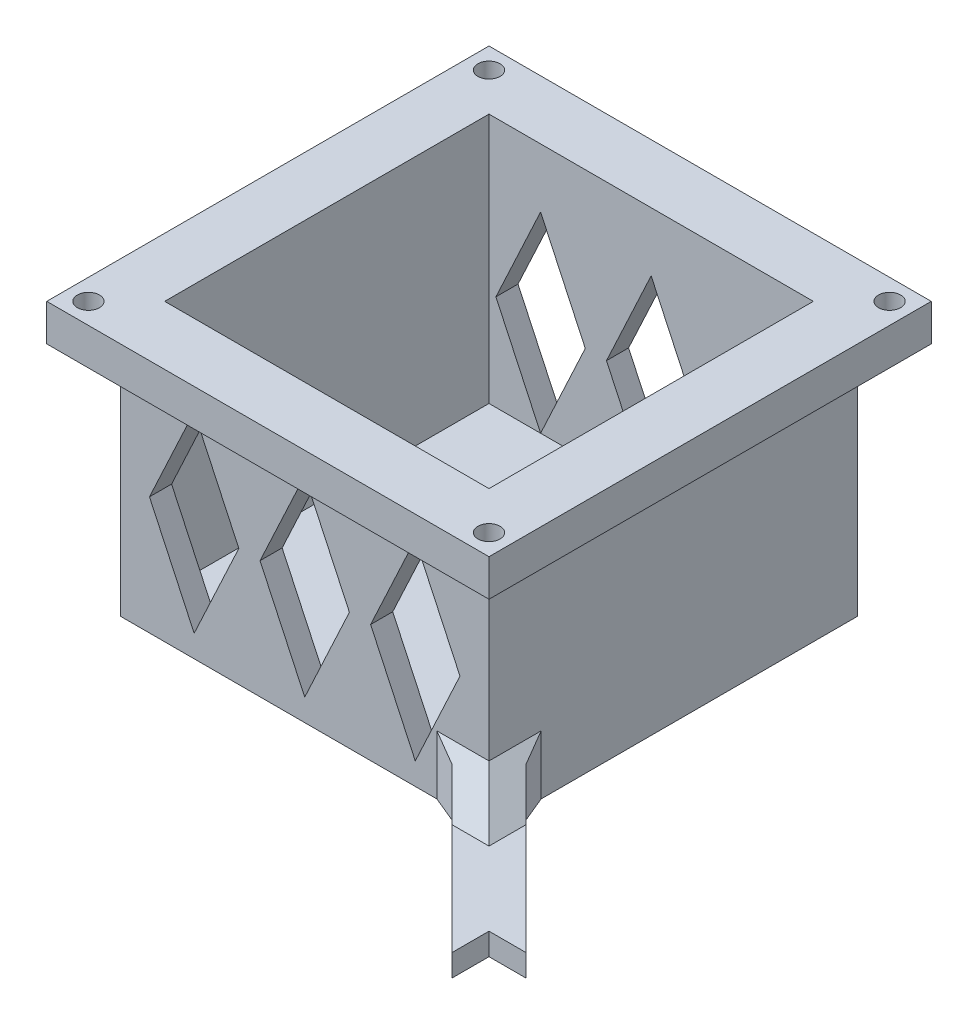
SolidWorks part; units mm, degrees
ref_plane "Front Plane" through (0, 0, 0) normal (0, 0, 1) x (1, 0, 0)
ref_plane "Top Plane" through (0, 0, 0) normal (0, 1, 0) x (1, 0, 0)
ref_plane "Right Plane" through (0, 0, 0) normal (1, 0, 0) x (0, 0, -1)
sketch "Sketch2" plane through (0, 0, 0) normal (0, 1, 0) x (1, 0, 0)
  line L1 (0, 0) -> (50, 0)
  line L2 (0, 0) -> (0, 50)
  line L3 (0, 50) -> (50, 50)
  line L4 (50, 0) -> (50, 50)
  dimension "D1" = 50
  dimension "D2" = 50
extrude "Boss-Extrude1" add sketch "Sketch2" along normal blind 37
sketch "Sketch3" plane through (0, 37, 0) normal (0, 1, 0) x (1, 0, 0)
  line L8 (3, 47) -> (3, 3)
  line L9 (3, 3) -> (47, 3)
  line L10 (47, 3) -> (47, 47)
  line L11 (47, 47) -> (3, 47)
  line L12 (3, 47) -> (3, 3)
  line L13 (3, 3) -> (47, 3)
  line L14 (47, 3) -> (47, 47)
  line L15 (47, 47) -> (3, 47)
  dimension "D1" = 3
extrude "Cut-Extrude1" cut sketch "Sketch3" against normal offset from surface (34 mm away) 3
sketch "Sketch4" plane through (0, 0, 0) normal (0, -1, 0) x (1, 0, 0)
  line L0 (50, 0) -> (50, 15) construction
  line L1 (50, 15) -> (65, 15) construction
  line L2 (50, 0) -> (45, 0)
  line L3 (0, 0) -> (50, 0) construction
  line L4 (45, 0) -> (45, 20)
  line L5 (45, 20) -> (65, 20)
  line L6 (65, 20) -> (65, 15)
  line L7 (65, 15) -> (70, 15)
  line L8 (70, 15) -> (70, -5)
  line L9 (70, -5) -> (50, -5)
  line L10 (50, 0) -> (50, -50) construction
  line L11 (50, -5) -> (50, 0)
  dimension "D1" = 15
  dimension "D2" = 15
  dimension "D3" = 5
  dimension "D4" = 20
  dimension "D5" = 20
  dimension "D6" = 5
extrude "Boss-Extrude2" add sketch "Sketch4" against normal blind 3
sketch "Sketch10" plane through (0, 37, 0) normal (0, 1, 0) x (1, 0, 0)
  line L8 (-5, 55) -> (-5, -5)
  line L9 (-5, -5) -> (55, -5)
  line L10 (55, -5) -> (55, 55)
  line L11 (55, 55) -> (-5, 55)
  line L12 (-5, 55) -> (-5, -5)
  line L13 (-5, -5) -> (55, -5)
  line L14 (55, -5) -> (55, 55)
  line L15 (55, 55) -> (-5, 55)
  line L26 (3, 3) -> (47, 3)
  line L27 (47, 3) -> (47, 47)
  line L28 (3, 47) -> (3, 3)
  line L29 (47, 47) -> (3, 47)
  line L30 (3, 3) -> (47, 3)
  line L31 (47, 3) -> (47, 47)
  line L32 (3, 47) -> (3, 3)
  line L33 (47, 47) -> (3, 47)
  dimension "D1" = 5
  dimension "D2" = 0
extrude "Boss-Extrude4" add sketch "Sketch10" against normal blind 5
sketch "Sketch11" plane through (0, 37, 0) normal (0, 1, 0) x (1, 0, 0)
  line L0 (-5, 55) -> (-2.1716, 52.1716) construction
  line L1 (55, 55) -> (52.1716, 52.1716) construction
  line L2 (55, -5) -> (52.1716, -2.1716) construction
  line L3 (-5, -5) -> (-2.1716, -2.1716) construction
  line L4 (55, 55) -> (-5, 55) construction
  line L5 (-5, -5) -> (55, -5) construction
  line L6 (-5, 55) -> (-5, -5) construction
  circle A0 centre (-2.1716, 52.1716) radius 1.5
  circle A1 centre (52.1716, 52.1716) radius 1.5
  circle A2 centre (52.1716, -2.1716) radius 1.5
  circle A3 centre (-2.1716, -2.1716) radius 1.5
  dimension "D5" = 3
  dimension "D6" = 3
  dimension "D7" = 3
  dimension "D8" = 3
  dimension "D1" = 4
  dimension "D2" = 4
  dimension "D3" = 4
  dimension "D4" = 4
  dimension "D9" = 45
  dimension "D10" = 45
  dimension "D11" = 45
  dimension "D12" = 45
extrude "Cut-Extrude2" cut sketch "Sketch11" against normal up to next
sketch "Sketch12" plane through (0, 3, 0) normal (0, 1, 0) x (1, 0, 0)
  line L0 (50, 5) -> (70, -15)
  line L1 (70, -15) -> (70, 5)
  line L2 (70, 5) -> (50, 5)
  line L3 (65, -20) -> (45, 0)
  line L4 (45, 0) -> (45, -20)
  line L5 (45, -20) -> (65, -20)
extrude "Cut-Extrude3" cut sketch "Sketch12" against normal blind 10
sketch "Sketch15" plane through (0, 0, -50) normal (0, 0, -1) x (-1, 0, 0)
  line L0 (-47, 16) -> (-3, 16) construction
  line L1 (-25, 29) -> (-31.062, 16)
  line L2 (-31.062, 16) -> (-25, 3)
  line L3 (-25, 29) -> (-25, 3) construction
  line L4 (-18.938, 16) -> (-25, 3)
  line L5 (-25, 29) -> (-18.938, 16)
  line L6 (-10, 29) -> (-16.062, 16)
  line L7 (-10, 29) -> (-3.938, 16)
  line L8 (-3, 29) -> (-47, 29)
  line L9 (-47, 29) -> (-47, 3)
  line L10 (-47, 3) -> (-3, 3)
  line L11 (-3, 3) -> (-3, 29)
  line L12 (-3, 29) -> (-47, 29) construction
  line L13 (-47, 29) -> (-47, 3) construction
  line L14 (-47, 3) -> (-3, 3) construction
  line L15 (-3, 3) -> (-3, 29) construction
  line L16 (-3.938, 16) -> (-10, 3)
  line L17 (-16.062, 16) -> (-10, 3)
  line L18 (-40, 29) -> (-46.062, 16)
  line L19 (-40, 29) -> (-33.938, 16)
  line L20 (-33.938, 16) -> (-40, 3)
  line L21 (-46.062, 16) -> (-40, 3)
  point P5 (-28.031, 9.5)
  dimension "D2" = 130
  dimension "D1" = 3
  dimension "D3" = 2
  dimension "D4" = 2
extrude "Cut-Extrude4" cut sketch "Sketch15" against normal blind 68
fillet "Chamfer1" radius 5 4 edges at (47.5, 3, 0) (50, 3, -2.5) (45, 1.5, 0) (50, 1.5, -5)
